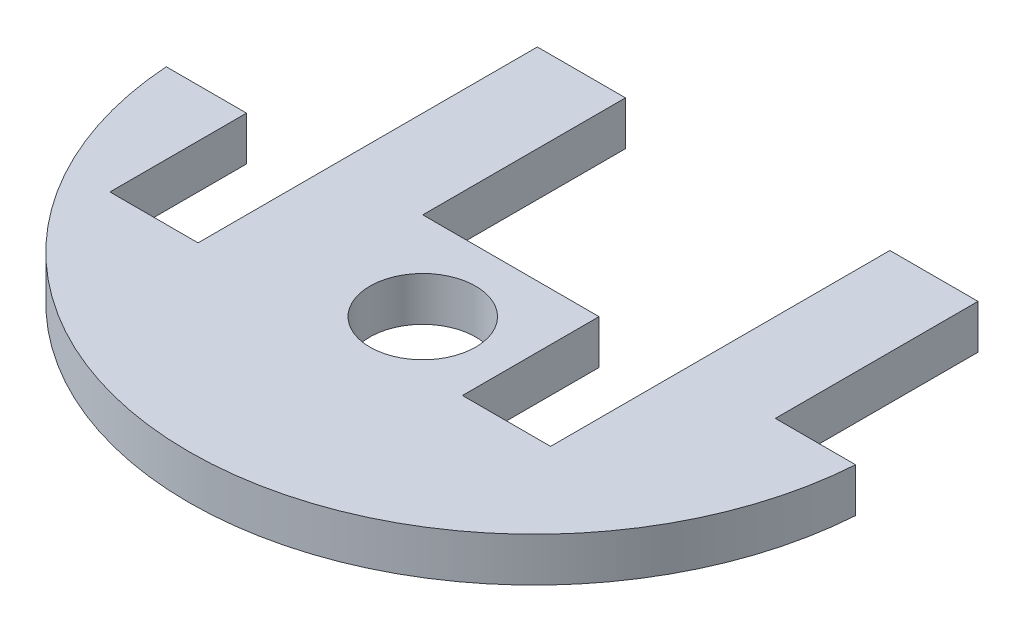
SolidWorks part; units mm, degrees
ref_plane "Front Plane" through (0, 0, 0) normal (0, 0, 1) x (1, 0, 0)
ref_plane "Top Plane" through (0, 0, 0) normal (0, 1, 0) x (1, 0, 0)
ref_plane "Right Plane" through (0, 0, 0) normal (1, 0, 0) x (0, 0, -1)
sketch "Sketch1" plane through (0, 0, 0) normal (0, 1, 0) x (1, 0, 0)
  circle A0 centre (0, 0) radius 24.892
  dimension "D1" = 49.784
extrude "Boss-Extrude1" add sketch "Sketch1" along normal blind 3.175
sketch "Sketch2" plane through (0, 3.175, 0) normal (0, 1, 0) x (1, 0, 0)
  line L0 (-27.6658, 0) -> (28.3657, 0) construction
  line L1 (-30.9048, 1.9201) -> (-28.121, 27.3162)
  line L2 (-30.9048, -1.6891) -> (27.1869, -1.6891)
  line L3 (-30.9048, -1.6891) -> (-30.9048, 1.9201)
  line L5 (27.1869, -1.6891) -> (27.1869, 1.4859)
  line L6 (-30.9048, -1.6891) -> (27.1869, 1.4859) construction
  line L7 (-30.9048, 1.9201) -> (27.1869, -1.6891) construction
  line L8 (-28.121, 27.3162) -> (-0.9675, 28.1729)
  line L9 (-0.9675, 28.1729) -> (21.7864, 24.8095)
  line L10 (21.7864, 24.8095) -> (27.1869, 1.4859)
  point P3 (0, 0)
extrude "Cut-Extrude1" cut sketch "Sketch2" against normal through all
sketch "Sketch3" plane through (0, 3.175, 0) normal (0, 1, 0) x (1, 0, 0)
  line L0 (0, -24.892) -> (0, 14.6249) construction
  line L1 (-24.8346, -1.6891) -> (24.8346, -1.6891) construction
  line L2 (12.7, -1.6891) -> (19.05, -1.6891)
  line L3 (12.7, -1.6891) -> (12.7, 12.9159)
  line L4 (12.7, 12.9159) -> (19.05, 12.9159)
  line L5 (19.05, -1.6891) -> (19.05, 12.9159)
  line L7 (-6.35, -1.6891) -> (-12.7, -1.6891)
  line L8 (-6.35, -1.6891) -> (-6.35, 12.9159)
  line L9 (-6.35, 12.9159) -> (-12.7, 12.9159)
  line L10 (-12.7, -1.6891) -> (-12.7, 12.9159)
  arc A0 (-24.8346, -1.6891) -> (24.8346, -1.6891) centre (0, 0) ccw construction
extrude "Boss-Extrude2" add sketch "Sketch3" against normal blind 3.175
sketch "Sketch5" plane through (0, 3.175, 0) normal (0, 1, 0) x (1, 0, 0)
  line L1 (12.7, -1.6891) -> (6.35, -1.6891)
  line L2 (12.7, -1.6891) -> (12.7, -11.5316)
  line L3 (12.7, -11.5316) -> (6.35, -11.5316)
  line L4 (6.35, -1.6891) -> (6.35, -11.5316)
  line L5 (-12.7, -1.6891) -> (-19.05, -1.6891)
  line L6 (-12.7, -1.6891) -> (-12.7, -11.5316)
  line L7 (-12.7, -11.5316) -> (-19.05, -11.5316)
  line L8 (-19.05, -1.6891) -> (-19.05, -11.5316)
extrude "Cut-Extrude2" cut sketch "Sketch5" against normal through all
sketch "Sketch6" plane through (0, 3.175, 0) normal (0, 1, 0) x (1, 0, 0)
  line L0 (6.35, -1.6891) -> (6.35, -11.5316) construction
  line L1 (-6.35, -1.6891) -> (6.35, -1.6891) construction
  circle A0 centre (0, -8.0391) radius 3.81
  dimension "D1" = 7.62
  dimension "D2" = 6.35
  dimension "D3" = 6.35
extrude "Cut-Extrude3" cut sketch "Sketch6" against normal through all
sketch "Sketch7" plane through (0, 3.175, 0) normal (0, 1, 0) x (1, 0, 0)
  line L26 (12.5984, 13.0175) -> (12.5984, -11.43)
  line L27 (12.5984, -11.43) -> (6.4516, -11.43)
  line L28 (6.4516, -11.43) -> (6.4516, -1.5875)
  line L29 (6.4516, -1.5875) -> (-6.2484, -1.5875)
  line L30 (-6.2484, -1.5875) -> (-6.2484, 13.0175)
  line L31 (-6.2484, 13.0175) -> (-12.8016, 13.0175)
  line L32 (-12.8016, 13.0175) -> (-12.8016, -11.43)
  line L33 (-12.8016, -11.43) -> (-18.9484, -11.43)
  line L34 (-18.9484, -11.43) -> (-18.9484, -1.5875)
  line L35 (-18.9484, -1.5875) -> (-24.9431, -1.5875)
  line L36 (24.9431, -1.5875) -> (19.1516, -1.5875)
  line L37 (19.1516, -1.5875) -> (19.1516, 13.0175)
  line L38 (19.1516, 13.0175) -> (12.5984, 13.0175)
  line L39 (12.5984, 13.0175) -> (12.5984, -11.43)
  line L40 (12.5984, -11.43) -> (6.4516, -11.43)
  line L41 (6.4516, -11.43) -> (6.4516, -1.5875)
  line L42 (6.4516, -1.5875) -> (-6.2484, -1.5875)
  line L43 (-6.2484, -1.5875) -> (-6.2484, 13.0175)
  line L44 (-6.2484, 13.0175) -> (-12.8016, 13.0175)
  line L45 (-12.8016, 13.0175) -> (-12.8016, -11.43)
  line L46 (-12.8016, -11.43) -> (-18.9484, -11.43)
  line L47 (-18.9484, -11.43) -> (-18.9484, -1.5875)
  line L48 (-18.9484, -1.5875) -> (-24.9431, -1.5875)
  line L49 (24.9431, -1.5875) -> (19.1516, -1.5875)
  line L50 (19.1516, -1.5875) -> (19.1516, 13.0175)
  line L51 (19.1516, 13.0175) -> (12.5984, 13.0175)
  arc A2 (-24.9431, -1.5875) -> (24.9431, -1.5875) centre (0, 0) ccw
  arc A3 (-24.9431, -1.5875) -> (24.9431, -1.5875) centre (0, 0) ccw
  circle A5 centre (0, -8.0391) radius 3.7084
  circle A6 centre (0, -8.0391) radius 3.7084
equation "\"D3@Sketch5\"=\"tang\"-\"t\"/2"
equation "\"D4@Sketch5\"=\"tang\"-\"t\"/2"
equation "\"t\"= .125in"
equation "\"kerf\"= .004in"
equation "\"D1@Boss-Extrude1\"=\"t\""
equation "\"D1@Sketch2\"=\"t\""
equation "\"D1@Boss-Extrude2\"=\"t\""
equation "\"D1@Sketch7\"=\"kerf\""
equation "\"D2@Sketch7\"=\"kerf\""
equation "\"tang\"= .45in"
equation "\"D4@Sketch3\"=\"tang\"+\"t\""
equation "\"D3@Sketch3\"=\"tang\"+\"t\""
